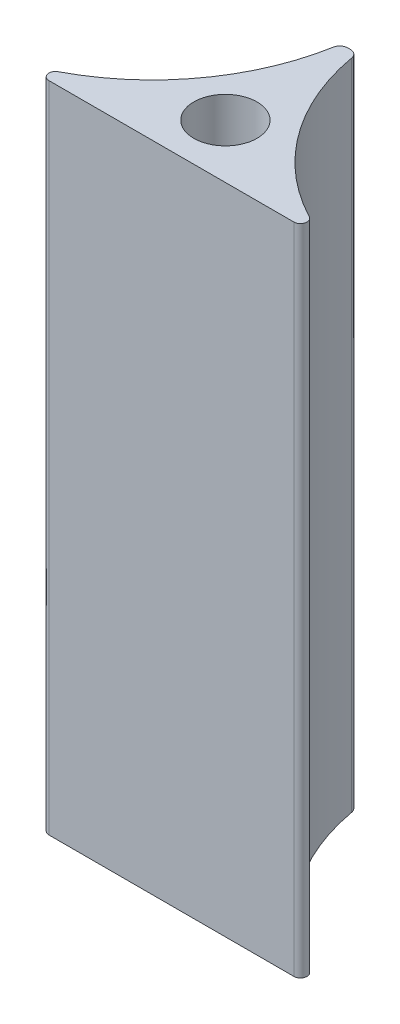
SolidWorks part; units mm, degrees
ref_plane "Front Plane" through (0, 0, 0) normal (0, 0, 1) x (1, 0, 0)
ref_plane "Top Plane" through (0, 0, 0) normal (0, 1, 0) x (1, 0, 0)
ref_plane "Right Plane" through (0, 0, 0) normal (1, 0, 0) x (0, 0, -1)
sketch "Sketch1" plane through (0, 0, 0) normal (0, 1, 0) x (1, 0, 0)
  line L0 (0.635, -2.54) -> (-0.635, -2.54)
  line L1 (9.525, -16.3634) -> (-9.525, -16.3634)
  line L2 (0, -2.54) -> (0, -16.3634) construction
  line L3 (0, 0) -> (0, -2.54) construction
  arc A0 (-9.525, -16.3634) -> (-9.7611, -15.4056) centre (-9.525, -15.8554) cw
  arc A1 (9.7611, -15.4056) -> (0.635, -2.54) centre (17.8476, 0) cw
  arc A2 (9.525, -16.3634) -> (9.7611, -15.4056) centre (9.525, -15.8554) ccw
  arc A3 (-9.7611, -15.4056) -> (-0.635, -2.54) centre (-17.8476, 0) ccw
  point P16 (11.9346, -16.3634)
  point P19 (-25.3578, -12.7)
  dimension "D2" = 1.27
  dimension "D5" = 0.508
  dimension "D1" = 17.399
  dimension "D3" = 19.05
  dimension "D4" = 2.54
extrude "Boss-Extrude1" add sketch "Sketch1" along normal blind 50.8
ref_plane "Plane1" through (17.78, 0, 0) normal (1, 0, 0) x (0, 0, -1)
ref_plane "Plane2" through (-17.78, 0, 0) normal (1, 0, 0) x (0, 0, -1)
ref_plane "Plane3" through (0, 0, 0) normal (0, 0, 1) x (1, 0, 0)
hole_wizard "#10 (0.1935) Diameter Hole1" positions "Sketch3" profile "Sketch2" hole size "#10" standard "ANSI Inch"
sketch "Sketch3" plane through (0, 50.8, 0) normal (0, 1, 0) x (1, 0, 0)
  line L0 (9.525, -16.3634) -> (-9.525, -16.3634) construction
  circle A0 centre (0, -12.1639) radius 4.1995 construction
  arc A1 (-9.7611, -15.4056) -> (-0.635, -2.54) centre (-17.8476, 0) ccw construction
  arc A2 (0.635, -2.54) -> (9.7611, -15.4056) centre (17.8476, 0) ccw construction
  point P0 (0, -12.1639)
sketch "Sketch2" plane through (0, 50.8, 12.1639) normal (1, 0, 0) x (0, 0, 1)
  line L0 (0, 0) -> (0, 50.8)
  line L1 (0, 50.8) -> (2.4574, 50.8)
  line L2 (2.4574, 50.8) -> (2.4574, 0)
  line L5 (2.4574, 0) -> (0, 0)
  line L11 (0, -6.35) -> (0, 107.95) construction
  dimension "Thru Hole Dia." = 4.9149
  dimension "Thru Hole Depth" = 50.8
fillet "Fillet1" radius 0.635 2 edges at (-0.635, 25.4, 2.54) (0.635, 25.4, 2.54)
